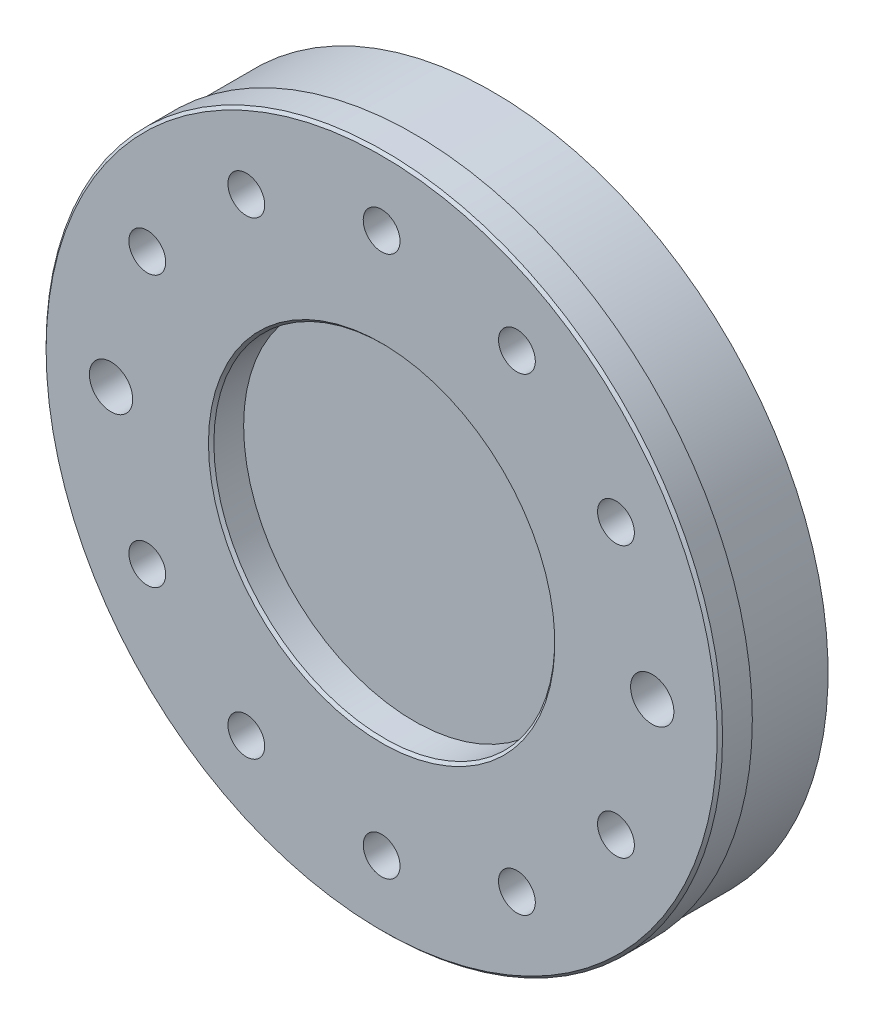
SolidWorks part; units mm, degrees
ref_plane "Front Plane" through (0, 0, 0) normal (0, 0, 1) x (1, 0, 0)
ref_plane "Top Plane" through (0, 0, 0) normal (0, 1, 0) x (1, 0, 0)
ref_plane "Right Plane" through (0, 0, 0) normal (1, 0, 0) x (0, 0, -1)
sketch "Sketch1" plane through (0, 0, 0) normal (0, 1, 0) x (1, 0, 0)
  line L0 (0, 20.5) -> (0, 0)
  line L7 (62, 20.5) -> (62, 6)
  line L8 (0, 20.5) -> (62, 20.5)
  line L9 (0, 20.5) -> (0, 0) construction
  line L10 (0, 0) -> (62.5, 0)
  line L11 (62, 6) -> (62.5, 6)
  line L12 (62.5, 6) -> (62.5, 0)
  dimension "D1" = 20.5
  dimension "D5" = 125
  dimension "D6" = 124
  dimension "D8" = 6
revolve "Revolve1" add sketch "Sketch1" angle 360 about L0
sketch "Sketch2" plane through (-20.5, 0, 0) normal (0, 0, -1) x (-1, 0, 0)
  circle A0 centre (-20.5, 0) radius 31.5
  dimension "D1" = 63
extrude "Cut-Extrude1" cut sketch "Sketch2" along normal blind 6
chamfer "Chamfer1" distance 0.5 angle 45 2 edges at (-62.5, 0, 0) (-31.5, 0, 0)
sketch "Sketch7" plane through (0, 0, 0) normal (0, 0, 1) x (1, 0, 0)
  circle A0 centre (0, 0) radius 50 construction
  dimension "D1" = 100
hole_wizard "Ø8.0 (8) Diameter Hole1" positions "Sketch4" profile "Sketch3" hole size "Ø8.0" standard "Ansi Metric"
sketch "Sketch4" plane through (22.0921, 42.0383, 0) normal (0, 0, 1) x (1, 0, 0)
  circle A1 centre (-22.0921, -42.0383) radius 50 construction
  point P0 (27.9079, -42.0383)
  point P6 (-72.0921, -42.0383)
sketch "Sketch3" plane through (50, 0, 0) normal (1, 0, 0) x (0, -1, 0)
  line L0 (0, 0) -> (0, 17.4034)
  line L1 (0, 17.4034) -> (4, 15)
  line L2 (4, 15) -> (4, 0)
  line L5 (4, 0) -> (0, 0)
  line L10 (0, 17.4034) -> (-4, 15) construction
  line L11 (0, -6.35) -> (0, 107.95) construction
  dimension "Hole Dia." = 8
  dimension "Hole Depth" = 15
  dimension "Drill Angle" = 118
hole_wizard "M8x1.25 Tapped Hole1" positions "Sketch6" profile "Sketch5" tap size "M8x1.25" standard "Ansi Metric"
sketch "Sketch6" plane through (68.9593, 32.7067, 0) normal (0, 0, -1) x (-1, 0, 0)
  circle A1 centre (68.9593, -32.7067) radius 50 construction
  point P0 (68.9593, -82.7067)
sketch "Sketch5" plane through (0, -50, 0) normal (1, 0, 0) x (0, -1, 0)
  line L0 (0, 0) -> (0, 20.0429)
  line L1 (0, 20.0429) -> (3.4, 18)
  line L2 (3.4, 18) -> (3.4, 0)
  line L5 (3.4, 0) -> (0, 0)
  line L10 (0, 20.0429) -> (-3.4, 18) construction
  line L11 (0, -6.35) -> (0, 107.95) construction
  dimension "Tap Drill Dia." = 6.8
  dimension "Tap Drill Depth" = 18
  dimension "Drill Angle" = 118
pattern_circular "CirPattern1" count 12 over 360 about axis through (0, 0, 0) along (0, 0, 1) of "M8x1.25 Tapped Hole1"
